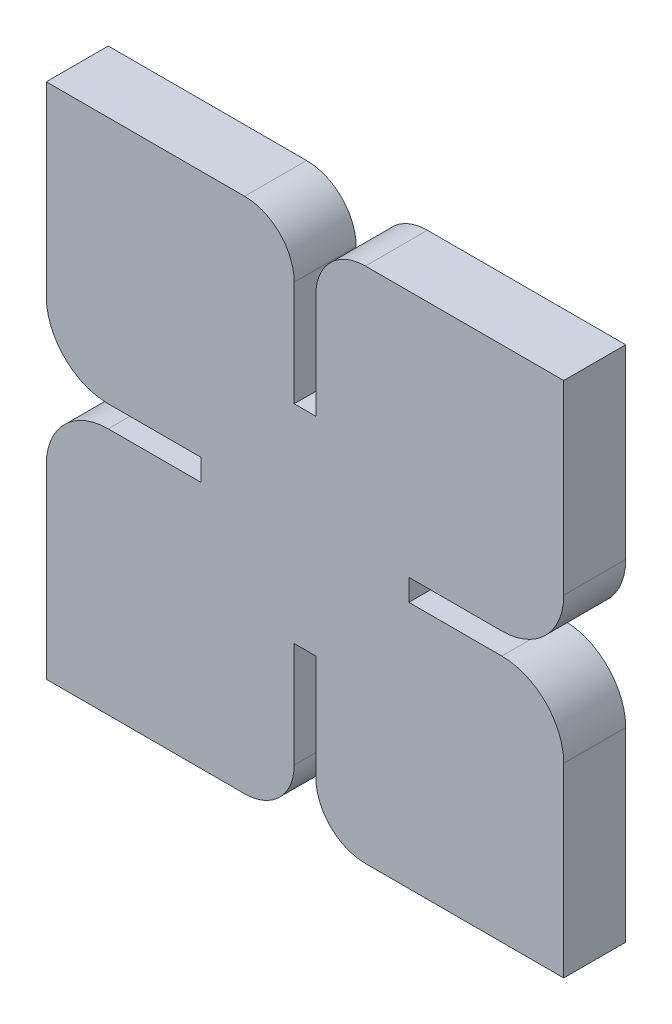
SolidWorks part; units mm, degrees
ref_plane "Front Plane" through (0, 0, 0) normal (0, 0, 1) x (1, 0, 0)
ref_plane "Top Plane" through (0, 0, 0) normal (0, 1, 0) x (1, 0, 0)
ref_plane "Right Plane" through (0, 0, 0) normal (1, 0, 0) x (0, 0, -1)
sketch "Sketch1" plane through (0, 0, 0) normal (0, 0, 1) x (1, 0, 0)
  line L0 (0, 56.5994) -> (0, -33.9185) construction
  line L1 (1.75, 16.75) -> (1.75, 33.75)
  line L2 (-16.75, 1.75) -> (-16.75, -1.75)
  line L3 (-1.75, 16.75) -> (1.75, 16.75)
  line L4 (41.75, 41.75) -> (9.75, 41.75)
  line L5 (41.75, 11.75) -> (41.75, 41.75)
  line L6 (31.75, 1.75) -> (16.75, 1.75)
  line L7 (-31.75, 1.75) -> (-16.75, 1.75)
  line L8 (-41.75, 11.75) -> (-41.75, 41.75)
  line L9 (-41.75, 41.75) -> (-9.75, 41.75)
  line L10 (-1.75, 16.75) -> (-1.75, 33.75)
  line L11 (16.75, 1.75) -> (16.75, -1.75)
  line L12 (-1.75, -16.75) -> (-1.75, -33.75)
  line L13 (-41.75, -41.75) -> (-9.75, -41.75)
  line L14 (-41.75, -11.75) -> (-41.75, -41.75)
  line L15 (-31.75, -1.75) -> (-16.75, -1.75)
  line L16 (31.75, -1.75) -> (16.75, -1.75)
  line L17 (41.75, -11.75) -> (41.75, -41.75)
  line L18 (41.75, -41.75) -> (9.75, -41.75)
  line L19 (-47.3502, 0) -> (63.8446, 0) construction
  line L20 (-1.75, -16.75) -> (1.75, -16.75)
  line L21 (1.75, -16.75) -> (1.75, -33.75)
  arc A0 (-1.75, 33.75) -> (-9.75, 41.75) centre (-9.75, 33.75) ccw
  arc A1 (31.75, 1.75) -> (41.75, 11.75) centre (31.75, 11.75) ccw
  arc A2 (1.75, 33.75) -> (9.75, 41.75) centre (9.75, 33.75) cw
  arc A3 (-31.75, -1.75) -> (-41.75, -11.75) centre (-31.75, -11.75) ccw
  arc A4 (1.75, -33.75) -> (9.75, -41.75) centre (9.75, -33.75) ccw
  arc A5 (31.75, -1.75) -> (41.75, -11.75) centre (31.75, -11.75) cw
  arc A6 (-31.75, 1.75) -> (-41.75, 11.75) centre (-31.75, 11.75) cw
  arc A7 (-1.75, -33.75) -> (-9.75, -41.75) centre (-9.75, -33.75) cw
  point P0 (0, 0)
  point P3 (-1.75, 41.75)
  point P10 (-156.0365, -11.2807)
  point P12 (-156.0365, -11.2807)
  point P13 (-133.044, -4.2512)
  point P18 (-121.9935, -11.2807)
  point P27 (0, 16.75)
  point P29 (41.75, 1.75)
  point P30 (41.75, -1.75)
  point P44 (16.75, 0)
  point P47 (-41.75, -1.75)
  point P50 (-41.75, 1.75)
  point P53 (1.75, 41.75)
  point P54 (-16.75, 0)
  point P55 (1.75, -41.75)
  point P56 (0, -16.75)
  point P57 (-1.75, -41.75)
extrude "Boss-Extrude1" add sketch "Sketch1" along normal blind 10
equation "\"D1@Sketch1\"=\"A\""
equation "\"A\" = 40"
equation "\"D2@Sketch1\"=\"A\""
equation "\"D5@Sketch1\"=\"A\"/5"
equation "\"D3@Sketch1\"=70/\"A\""
equation "\"D7@Sketch1\"=70/\"A\"'"
